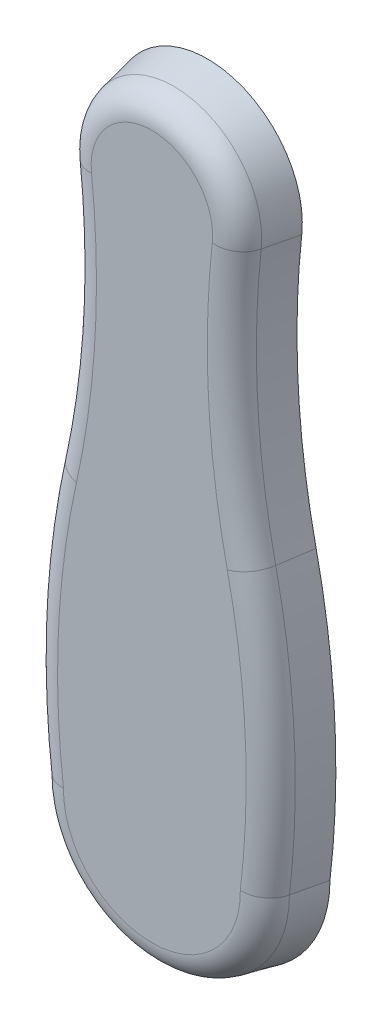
SolidWorks part; units mm, degrees
ref_plane "Front Plane" through (0, 0, 0) normal (0, 0, 1) x (1, 0, 0)
ref_plane "Top Plane" through (0, 0, 0) normal (0, 1, 0) x (1, 0, 0)
ref_plane "Right Plane" through (0, 0, 0) normal (1, 0, 0) x (0, 0, -1)
sketch "Sketch1" plane through (0, 0, 0) normal (0, 0, 1) x (1, 0, 0)
  line L0 (0, 200) -> (0, 0) construction
  arc A0 (-40, 0) -> (40, 0) centre (0, 0) ccw
  arc A1 (29.8258, 196.7715) -> (-29.8258, 196.7715) centre (0, 200) ccw
  arc A2 (-29.8258, 196.7715) -> (-35.0965, 100) centre (-328.0836, 164.4869) cw
  arc A3 (-35.0965, 100) -> (-40, 0) centre (257.8906, 35.5131) ccw
  arc A4 (29.8258, 196.7715) -> (35.0965, 100) centre (328.0836, 164.4869) ccw
  arc A5 (35.0965, 100) -> (40, 0) centre (-257.8906, 35.5131) cw
  dimension "D1" = 80
  dimension "D2" = 60
  dimension "D4" = 300
  dimension "D5" = 100
  dimension "D3" = 200
extrude "Boss-Extrude1" add sketch "Sketch1" along normal blind 20
draft "Draft2" type of draft neutral plane draft angle 12 faces to draft 4 parameters "D1"=12
fillet "Fillet2" radius 10 6 edges at (41.7494, 50.206, 20) (28.5275, 148.1715, 20) (-41.7494, 50.206, 20) (-28.5275, 148.1715, 20) (0, -40, 20) (0, 230, 20)
shell "Shell1" [suppressed] thickness 3
ref_plane "Plane1" through (0, 0, 5) normal (0, 0, -1) x (-1, 0, 0)
sketch "Sketch3" plane through (-0.6767, -1.1425, 5) normal (0, 0, -1) x (0, 1, 0)
  line L0 (40.5922, 28.4467) -> (40.5922, -23.4754)
  line L1 (128.418, 17.3994) -> (128.418, -14.0853)
rib "Rib1" [suppressed] sketch "Sketch3" sketch "Sketch3" thickness 2 extrusion direction normal to sketch draft on yes draft angle 8 parameters "D1"=2, "D3"=8
sketch "Sketch5" [suppressed] plane through (0, 0, 5) normal (0, 0, -1) x (-1, 0, 0)
  circle A0 centre (0, 170) radius 5
  dimension "D1" = 10
  dimension "D2" = 30
sketch3d "3DSketch1" [suppressed]
  circle A0 centre (0, 170, 5) radius 5 construction
  point P0 (0, 170, 17)
  point P3 (0, 170, 0)
other "Mounting Boss1" [suppressed] parameters "BossHeight"=12, "BossDiam"=6, "StepHeight"=1, "StepDia"=5, "HoleDiam"=3.2, "CBoreDiam"=5, "CBoreDepth"=1.5, "D8"=0, "D9"=0, "D10"=0, "Clearance"=0.254, "FinLength"=8, "FinWidth"=1, "FinHeight"=8, "ChamferDist"=2.4, "BossDraft"=2, "HoleDraft"=1, "StepDraft"=0, "D19"=0, "FinDraft"=1, "ChamferAngle"=60
